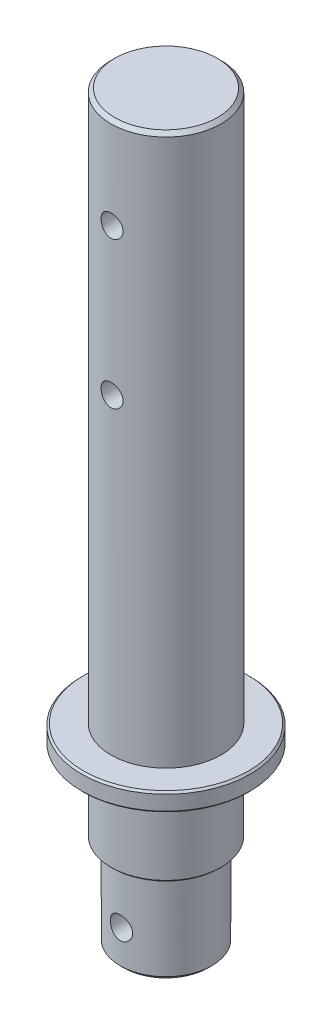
SolidWorks part; units mm, degrees
ref_plane "Plan de face" through (0, 0, 0) normal (0, 0, 1) x (1, 0, 0)
ref_plane "Plan de dessus" through (0, 0, 0) normal (0, 1, 0) x (1, 0, 0)
ref_plane "Plan de droite" through (0, 0, 0) normal (1, 0, 0) x (0, 0, -1)
sketch "Esquisse1" plane through (0, 0, 0) normal (0, 0, 1) x (1, 0, 0)
  line L0 (-15, 47) -> (-15, 25)
  line L1 (-15, 202) -> (0, 202)
  line L2 (-12.5, 25) -> (-12.5, 0)
  line L3 (-12.5, 0) -> (0, 0)
  line L4 (0, 202) -> (0, 0)
  line L5 (0, 215.7209) -> (0, -29.2364) construction
  line L7 (-12.5, 25) -> (-15, 25)
  line L8 (-15, 202) -> (-15, 52)
  line L9 (-15, 52) -> (-23, 52)
  line L11 (-15, 47) -> (-23, 47)
  line L12 (-23, 52) -> (-23, 47)
  dimension "D1" = 202
  dimension "D2" = 25
  dimension "D3" = 5
  dimension "D4" = 52
  dimension "D5" = 23
  dimension "D6" = 15
  dimension "D7" = 12.5
revolve "Révolution1" add sketch "Esquisse1" angle 360 about L5
chamfer "Chanfrein1" distance 1 angle 45 2 edges at (0, 0, 12.5) (0, 202, 15)
sketch "Esquisse2" plane through (0, 0, 0) normal (0, 0, 1) x (1, 0, 0)
  line L0 (14, 202) -> (-14, 202) construction
  line L1 (-11.5, 0) -> (11.5, 0) construction
  circle A0 centre (0, 177) radius 3
  circle A1 centre (0, 137) radius 3
  circle A2 centre (0, 10) radius 3.05
  dimension "D1" = 6
  dimension "D2" = 6
  dimension "D3" = 6.1
  dimension "D4" = 40
  dimension "D5" = 25
  dimension "D6" = 10
extrude "Enlèv. mat.-Extru.1" cut sketch "Esquisse2" against normal through all and the other way through all
chamfer "Chanfrein2" distance 0.5 angle 45 3 edges at (0, 25, 15) (0, 47, 23) (0, 52, 23)
